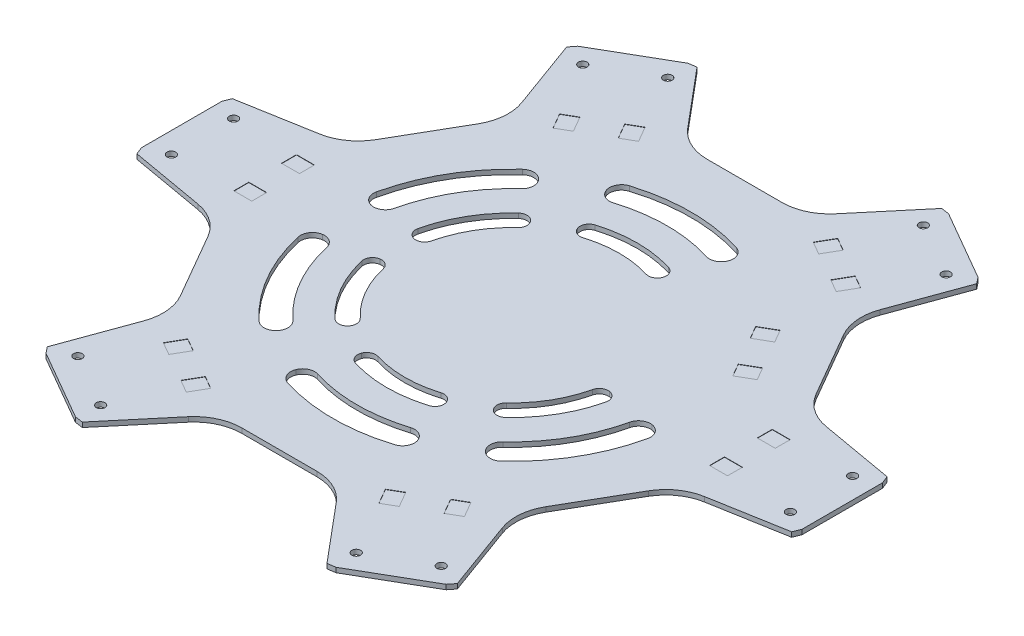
SolidWorks part; units mm, degrees
ref_plane "Front Plane" through (0, 0, 0) normal (0, 0, 1) x (1, 0, 0)
ref_plane "Top Plane" through (0, 0, 0) normal (0, 1, 0) x (1, 0, 0)
ref_plane "Right Plane" through (0, 0, 0) normal (1, 0, 0) x (0, 0, -1)
sketch "Sketch2" plane through (0, 0, 0) normal (0, 1, 0) x (1, 0, 0)
  line L0 (-110.75, -13.5) -> (-110.75, 13.5)
  line L1 (110.75, 0) -> (55.375, 95.9123) construction
  line L2 (55.375, 95.9123) -> (-55.375, 95.9123) construction
  line L3 (-55.375, 95.9123) -> (-110.75, 0) construction
  line L4 (-110.75, 0) -> (-55.375, -95.9123) construction
  line L5 (-55.375, -95.9123) -> (55.375, -95.9123) construction
  line L6 (55.375, -95.9123) -> (110.75, 0) construction
  line L7 (-110.75, 0) -> (0, 0) construction
  line L14 (0, 0) -> (0, 78) construction
  line L15 (-67.55, 39) -> (-90.0666, 0) construction
  line L16 (0, 78) -> (-67.55, 39) construction
  line L17 (-67.55, 39) -> (-67.55, -39) construction
  line L18 (-67.55, -39) -> (0, -78) construction
  line L19 (0, -78) -> (67.55, -39) construction
  line L20 (67.55, -39) -> (67.55, 39) construction
  line L21 (67.55, 39) -> (0, 78) construction
  line L22 (-110.75, 13.5) -> (-109.75, 13.5) construction
  line L23 (-67.55, 39) -> (-77.5583, 21.6651)
  line L24 (-109.75, 13.5) -> (-109.75, 16) construction
  line L25 (-110.75, 13.5) -> (-109.75, 16)
  line L26 (-77.5583, 21.6651) -> (-78.8083, 19.5) construction
  line L27 (-109.75, 16) -> (-77.5583, 21.6651)
  line L28 (-110.75, -13.5) -> (-109.75, -16)
  line L29 (-109.75, -16) -> (-77.5583, -21.6651)
  line L30 (-67.55, -39) -> (-77.5583, -21.6651)
  line L31 (-67.55, 39) -> (-57.5417, 56.3349)
  line L32 (-68.7314, 87.0463) -> (-57.5417, 56.3349)
  line L33 (-67.0663, 89.1623) -> (-68.7314, 87.0463)
  line L34 (-67.0663, 89.1623) -> (-43.6837, 102.6623)
  line L35 (-43.6837, 102.6623) -> (-41.0186, 103.0463)
  line L36 (-41.0186, 103.0463) -> (-20.0167, 78)
  line L37 (0, 78) -> (-20.0167, 78)
  line L38 (0, 78) -> (20.0167, 78)
  line L39 (41.0186, 103.0463) -> (20.0167, 78)
  line L40 (43.6837, 102.6623) -> (41.0186, 103.0463)
  line L41 (43.6837, 102.6623) -> (67.0663, 89.1623)
  line L42 (67.0663, 89.1623) -> (68.7314, 87.0463)
  line L43 (68.7314, 87.0463) -> (57.5417, 56.3349)
  line L44 (67.55, 39) -> (57.5417, 56.3349)
  line L45 (67.55, 39) -> (77.5583, 21.6651)
  line L46 (109.75, 16) -> (77.5583, 21.6651)
  line L47 (110.75, 13.5) -> (109.75, 16)
  line L48 (110.75, 13.5) -> (110.75, -13.5)
  line L49 (110.75, -13.5) -> (109.75, -16)
  line L50 (109.75, -16) -> (77.5583, -21.6651)
  line L51 (67.55, -39) -> (77.5583, -21.6651)
  line L52 (67.55, -39) -> (57.5417, -56.3349)
  line L53 (68.7314, -87.0463) -> (57.5417, -56.3349)
  line L54 (67.0663, -89.1623) -> (68.7314, -87.0463)
  line L55 (67.0663, -89.1623) -> (43.6837, -102.6623)
  line L56 (43.6837, -102.6623) -> (41.0186, -103.0463)
  line L57 (41.0186, -103.0463) -> (20.0167, -78)
  line L58 (0, -78) -> (20.0167, -78)
  line L59 (0, -78) -> (-20.0167, -78)
  line L60 (-41.0186, -103.0463) -> (-20.0167, -78)
  line L61 (-43.6837, -102.6623) -> (-41.0186, -103.0463)
  line L62 (-43.6837, -102.6623) -> (-67.0663, -89.1623)
  line L63 (-67.0663, -89.1623) -> (-68.7314, -87.0463)
  line L64 (-68.7314, -87.0463) -> (-57.5417, -56.3349)
  line L65 (-67.55, -39) -> (-57.5417, -56.3349)
  circle A0 centre (0, 0) radius 95.9123 construction
  circle A1 centre (0, 0) radius 67.55 construction
  point P67 (0, 0)
  dimension "D1" = 110.75
  dimension "D2" = 13.5
  dimension "D3" = 78
  dimension "D4" = 1
  dimension "D5" = 2.5
  dimension "D6" = 2.5
  dimension "D7" = 6
extrude "Base plate" add sketch "Sketch2" along normal blind 1.6 contours L30 L65 L64 L63 L62 L61 L60 L59 L58 L57 L56 L55 L54 L53 L52 L51 L50 L49 L48 L47 L46 L45 L44 L43 L42 L41 L40 L39 L38 L37 L36 L35 L34 L33 L32 L31 L23 L27 L25 L0 L28 L29
fillet "Fillet3" radius 16 12 edges at (-57.5417, 0.8, 56.3349) (-77.5583, 0.8, 21.6651) (-20.0167, 0.8, 78) (20.0167, 0.8, 78) (57.5417, 0.8, 56.3349) (77.5583, 0.8, 21.6651) (77.5583, 0.8, -21.6651) (57.5417, 0.8, -56.3349) (20.0167, 0.8, -78) (-20.0167, 0.8, -78) (-57.5417, 0.8, -56.3349) (-77.5583, 0.8, -21.6651)
sketch "Sketch3" plane through (0, 1.6, 0) normal (0, 1, 0) x (1, 0, 0)
  line L0 (-55.375, 95.9123) -> (-64.4076, 90.6973) construction
  line L1 (-67.0663, 89.1623) -> (-43.6837, 102.6623) construction
  line L2 (-64.4076, 90.6973) -> (-60.9076, 84.6351) construction
  line L3 (-55.375, 95.9123) -> (-46.3424, 101.1273) construction
  line L4 (-46.3424, 101.1273) -> (-42.8424, 95.0651) construction
  dimension "D3" = 10.43
  dimension "D4" = 7
hole_wizard "M3.5x0.6 Tapped Hole2" positions "Sketch4" profile "Sketch5" tap size "M3.5x0.6" standard "ANSI Metric"
sketch "Sketch4" plane through (0, 1.6, 0) normal (0, 1, 0) x (1, 0, 0)
  point P0 (-60.9076, 84.6351)
  point P3 (-42.8424, 95.0651)
sketch "Sketch5" plane through (-60.9076, 1.6, -84.6351) normal (1, 0, 0) x (0, 0, 1)
  line L0 (0, 0) -> (0, 9.6712)
  line L1 (0, 9.6712) -> (1.45, 8.8)
  line L2 (1.45, 8.8) -> (1.45, 0)
  line L5 (1.45, 0) -> (0, 0)
  line L10 (0, 9.6712) -> (-1.45, 8.8) construction
  line L11 (0, -6.35) -> (0, 107.95) construction
  dimension "Tap Drill Dia." = 2.9
  dimension "Tap Drill Depth" = 8.8
  dimension "Drill Angle" = 118
sketch "Sketch6" plane through (0, 0, 0) normal (1, 0, 0) x (0, 0, -1)
  line L0 (0, 0) -> (0, 50) construction
  dimension "D1" = 50
pattern_circular "CirPattern1" count 6 over 360 about axis through (0, 0, 0) along (0, 1, 0) of "M3.5x0.6 Tapped Hole2"
sketch "Sketch7" plane through (0, 1.6, 0) normal (0, 1, 0) x (1, 0, 0)
  line L0 (0, 52) -> (0, 60) construction
  line L1 (20.5, 52.1129) -> (19.0357, 48.3905)
  line L3 (0, 56) -> (-20.5, 56) construction
  line L4 (20.5, 52.1129) -> (21.9643, 55.8352)
  line L5 (0, 52) -> (0, 42) construction
  line L6 (-20.5, 52.1129) -> (-21.9643, 55.8352)
  line L7 (-20.5, 52.1129) -> (-19.0357, 48.3905)
  line L8 (0, 42) -> (0, 36) construction
  line L9 (-19.0357, 48.3905) -> (-15.375, 39.0846) construction
  line L10 (-15.375, 39.0846) -> (-13.1786, 33.5011)
  line L11 (15.375, 39.0846) -> (13.1786, 33.5011)
  arc A0 (21.9643, 55.8352) -> (-21.9643, 55.8352) centre (0, 0) ccw
  arc A1 (19.0357, 48.3905) -> (-19.0357, 48.3905) centre (0, 0) ccw
  arc A2 (0, 56) -> (-20.5, 52.1129) centre (0, 0) ccw construction
  arc A3 (15.375, 39.0846) -> (-15.375, 39.0846) centre (0, 0) ccw
  arc A4 (13.1786, 33.5011) -> (-13.1786, 33.5011) centre (0, 0) ccw
  dimension "D1" = 60
  dimension "D2" = 52
  dimension "D4" = 20.5
  dimension "D3" = 4
  dimension "D5" = 56
  dimension "D6" = 52
  dimension "D8" = 20.5
extrude "Cut-Extrude1" cut sketch "Sketch7" against normal up to next
fillet "Fillet4" radius 4 4 edges at (19.0357, 0.8, -48.3905) (21.9643, 0.8, -55.8352) (-19.0357, 0.8, -48.3905) (-21.9643, 0.8, -55.8352)
fillet "Fillet5" radius 3 4 edges at (13.1786, 0.8, -33.5011) (15.375, 0.8, -39.0846) (-13.1786, 0.8, -33.5011) (-15.375, 0.8, -39.0846)
pattern_circular "CirPattern2" count 5 every 60 about axis through (0, 0, 0) along (0, 1, 0) of "Cut-Extrude1", "Fillet4", "Fillet5"
sketch "Sketch8" plane through (0, 1.6, 0) normal (0, 1, 0) x (1, 0, 0)
  line L0 (-39.875, 69.0655) -> (0, 0) construction
  line L1 (-55.375, 95.9123) -> (-39.875, 69.0655) construction
  line L2 (-39.875, 69.0655) -> (-46.8032, 65.0655) construction
  line L3 (-46.8032, 65.0655) -> (-48.3032, 67.6636) construction
  line L4 (-48.3032, 67.6636) -> (-50.4683, 66.4136) construction
  line L5 (-50.4683, 66.4136) -> (-46.1381, 68.9136)
  line L6 (-46.1381, 68.9136) -> (-43.1381, 63.7174)
  line L7 (-43.1381, 63.7174) -> (-47.4683, 61.2174)
  line L8 (-47.4683, 61.2174) -> (-50.4683, 66.4136)
  line L9 (-33.6119, 69.2174) -> (-29.2817, 71.7174)
  line L10 (-36.6119, 74.4136) -> (-33.6119, 69.2174)
  line L11 (-32.2817, 76.9136) -> (-36.6119, 74.4136)
  line L12 (-29.2817, 71.7174) -> (-32.2817, 76.9136)
  dimension "D1" = 31
  dimension "D2" = 8
  dimension "D3" = 3
  dimension "D4" = 2.5
  dimension "D5" = 6
  dimension "D6" = 5
  dimension "D7" = 3
extrude "Cut-Extrude2" cut sketch "Sketch8" against normal blind 0.1
pattern_circular "CirPattern3" count 6 over 360 about axis through (0, 0, 0) along (0, 1, 0) of "Cut-Extrude2"
sketch "Sketch9" plane through (0, 1.6, 0) normal (0, 1, 0) x (1, 0, 0)
  line L0 (67.55, 39) -> (51.9615, 30) construction
  line L1 (61.2738, 49.8707) -> (73.8262, 28.1293) construction
  line L2 (51.9615, 30) -> (47.9615, 36.9282) construction
  line L3 (47.9615, 36.9282) -> (45.3634, 35.4282) construction
  line L4 (45.3634, 35.4282) -> (44.1134, 37.5933) construction
  line L5 (44.1134, 37.5933) -> (49.3096, 40.5933)
  line L6 (49.3096, 40.5933) -> (51.8096, 36.2631)
  line L7 (51.8096, 36.2631) -> (46.6134, 33.2631)
  line L8 (46.6134, 33.2631) -> (44.1134, 37.5933)
  line L9 (59.8096, 22.4067) -> (57.3096, 26.7369)
  line L10 (57.3096, 26.7369) -> (52.1134, 23.7369)
  line L11 (52.1134, 23.7369) -> (54.6134, 19.4067)
  line L12 (54.6134, 19.4067) -> (59.8096, 22.4067)
  dimension "D1" = 18
  dimension "D2" = 8
  dimension "D3" = 6
  dimension "D4" = 5
  dimension "D5" = 3
  dimension "D6" = 2.5
extrude "Cut-Extrude3" cut sketch "Sketch9" against normal blind 0.1 contours L11 L12 L9 L10 | L8 L7 L6 L5
sketch "Sketch11" plane through (-67.55, 0, 39) normal (-0.866, 0, 0.5) x (0.5, 0, 0.866)
  line L0 (0, 1.6) -> (0, 0) construction
  line L1 (12.5525, 1.6) -> (-12.5525, 1.6) construction
sketch "Sketch12" plane through (0, 0, 78) normal (0, 0, 1) x (1, 0, 0)
  line L0 (0, 1.6) -> (0, 0) construction
  line L1 (12.5525, 1.6) -> (-12.5525, 1.6) construction
  line L2 (12.5525, 0) -> (-12.5525, 0) construction
sketch "Sketch13" plane through (67.55, 0, 39) normal (0.866, 0, 0.5) x (0.5, 0, -0.866)
  line L0 (0, 1.6) -> (0, 0) construction
  line L1 (12.5525, 1.6) -> (-12.5525, 1.6) construction
  line L2 (12.5525, 0) -> (-12.5525, 0) construction
sketch "Sketch14" plane through (67.55, 0, -39) normal (0.866, 0, -0.5) x (-0.5, 0, -0.866)
  line L0 (0, 1.6) -> (0, 0) construction
  line L1 (12.5525, 1.6) -> (-12.5525, 1.6) construction
  line L2 (12.5525, 0) -> (-12.5525, 0) construction
sketch "Sketch15" plane through (0, 0, -78) normal (0, 0, -1) x (-1, 0, 0)
  line L0 (0, 1.6) -> (0, 0) construction
  line L1 (12.5525, 1.6) -> (-12.5525, 1.6) construction
  line L2 (12.5525, 0) -> (-12.5525, 0) construction
sketch "Sketch16" plane through (-67.55, 0, -39) normal (-0.866, 0, -0.5) x (-0.5, 0, 0.866)
  line L0 (0, 1.6) -> (0, 0) construction
  line L1 (12.5525, 1.6) -> (-12.5525, 1.6) construction
  line L2 (12.5525, 0) -> (-12.5525, 0) construction
sketch "Sketch17" plane through (0, 1.6, 0) normal (0, 1, 0) x (1, 0, 0)
  line L0 (67.55, 39) -> (-67.55, -39) construction
  line L1 (-61.2738, -49.8707) -> (-73.8262, -28.1293) construction
  line L2 (-67.55, 39) -> (67.55, -39) construction
  line L3 (-73.8262, 28.1293) -> (-61.2738, 49.8707) construction
  line L4 (0, 78) -> (0, -78) construction
  line L5 (-12.5525, 78) -> (12.5525, 78) construction
  line L6 (12.5525, -78) -> (-12.5525, -78) construction
